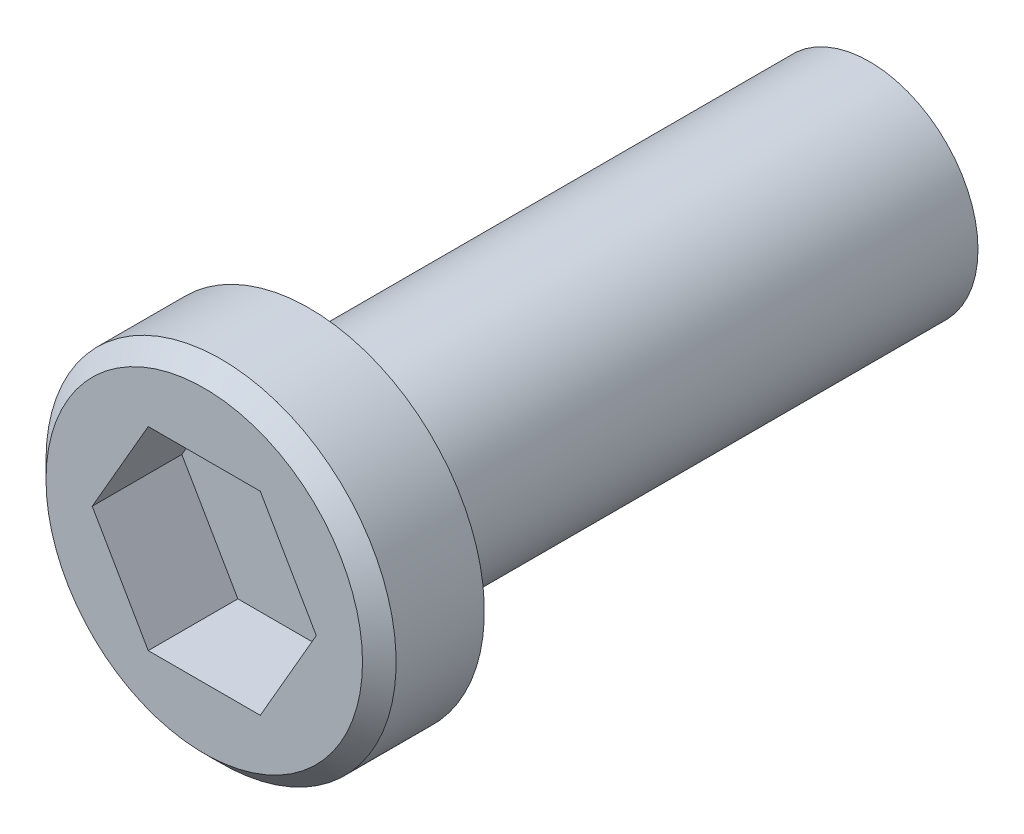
SolidWorks part; units mm, degrees
ref_plane "Front" through (0, 0, 0) normal (0, 0, 1) x (1, 0, 0)
ref_plane "Top" through (0, 0, 0) normal (0, 1, 0) x (1, 0, 0)
ref_plane "Right" through (0, 0, 0) normal (1, 0, 0) x (0, 0, -1)
sketch "Sketch1" plane through (0, 0, 0) normal (0, 0, 1) x (1, 0, 0)
  circle A0 centre (0, 0) radius 4.9213
  dimension "D1" = 9.8425
extrude "Extrude1" add sketch "Sketch1" along normal blind 25.4
sketch "Sketch2" plane through (0, 0, 25.4) normal (0, 0, 1) x (1, 0, 0)
  circle A0 centre (0, 0) radius 7.9375
  dimension "D1" = 15.875
extrude "Extrude2" add sketch "Sketch2" along normal blind 4.7625
chamfer "Chamfer1" distance 0.762 angle 45
sketch "Sketch3" plane through (0, 0, 30.1625) normal (0, 0, 1) x (1, 0, 0)
  line L1 (5.08, 0) -> (2.54, 4.3994)
  line L2 (2.54, 4.3994) -> (-2.54, 4.3994)
  line L3 (-2.54, 4.3994) -> (-5.08, 0)
  line L4 (-5.08, 0) -> (-2.54, -4.3994)
  line L5 (-2.54, -4.3994) -> (2.54, -4.3994)
  line L6 (2.54, -4.3994) -> (5.08, 0)
  circle A0 centre (0, 0) radius 4.3994 construction
  dimension "D1" = 5.08
extrude "Cut-Extrude1" cut sketch "Sketch3" against normal blind 4.064
